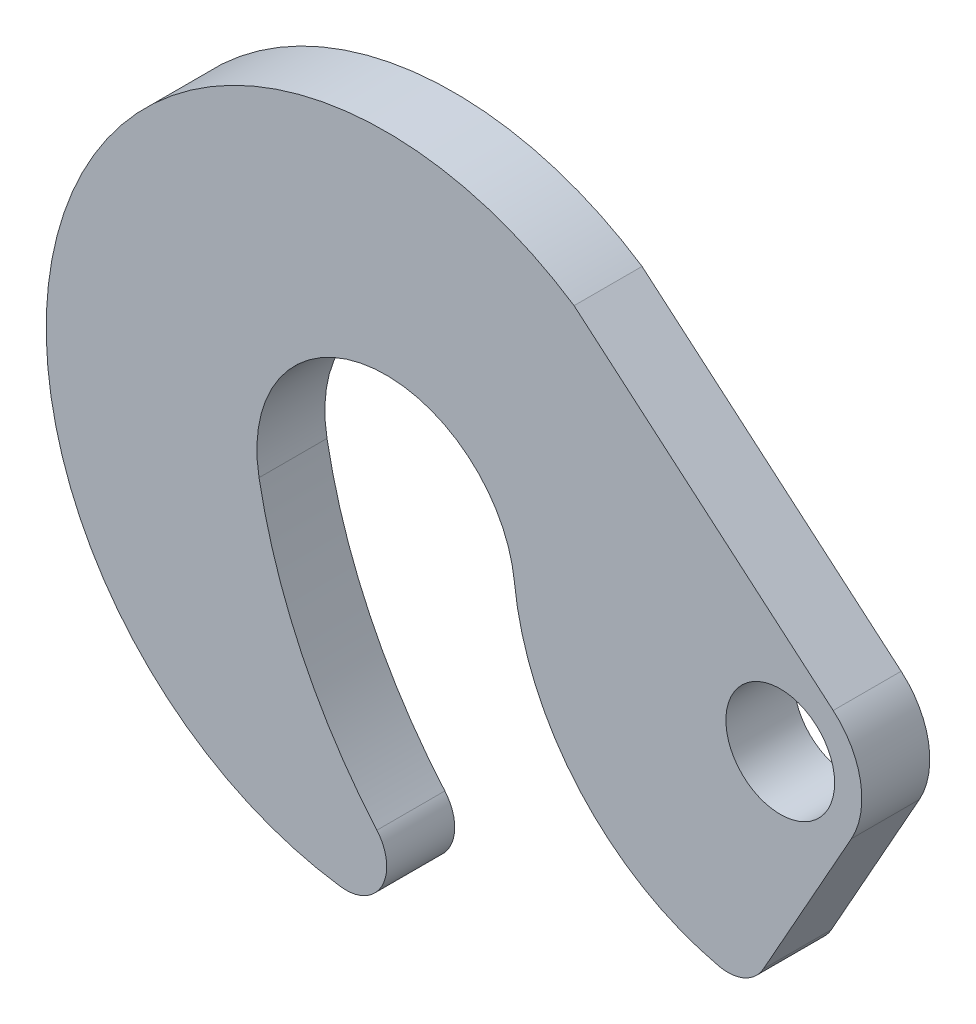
SolidWorks part; units mm, degrees
ref_plane "Plan de face" through (0, 0, 0) normal (0, 0, 1) x (1, 0, 0)
ref_plane "Plan de dessus" through (0, 0, 0) normal (0, 1, 0) x (1, 0, 0)
ref_plane "Plan de droite" through (0, 0, 0) normal (1, 0, 0) x (0, 0, -1)
sketch "Esquisse1" plane through (0, 0, 0) normal (0, 0, 1) x (1, 0, 0)
  line L0 (27.6635, 41.6501) -> (65.7877, 9.1297)
  line L1 (55.5176, -28.937) -> (68.464, -5.874)
  arc A0 (27.6635, 41.6501) -> (-6.7001, -49.549) centre (0, 0) ccw
  arc A1 (-6.7001, -49.549) -> (-1.3465, -39.6915) centre (-5.8961, -43.6032) ccw
  arc A2 (-1.3465, -39.6915) -> (-18.6856, -3.4423) centre (57.0402, 10.5081) cw
  arc A3 (-18.6856, -3.4423) -> (18.8924, 2.0188) centre (0, 0) cw
  arc A4 (18.8924, 2.0188) -> (48.9426, -31.8478) centre (57.6717, 6.1628) ccw
  arc A5 (48.9426, -31.8478) -> (55.5176, -28.937) centre (50.2856, -26) ccw
  arc A6 (68.464, -5.874) -> (65.7877, 9.1297) centre (58, 0) ccw
  circle A7 centre (58, 0) radius 8
  dimension "D1" = 100
  dimension "D2" = 6
  dimension "D3" = 77
  dimension "D4" = 19
  dimension "D5" = 39
  dimension "D8" = 6
  dimension "D9" = 12
  dimension "D10" = 16
  dimension "D6" = 26
  dimension "D7" = 0
  dimension "D11" = 58
extrude "Boss.-Extru.1" add sketch "Esquisse1" along normal blind 10
